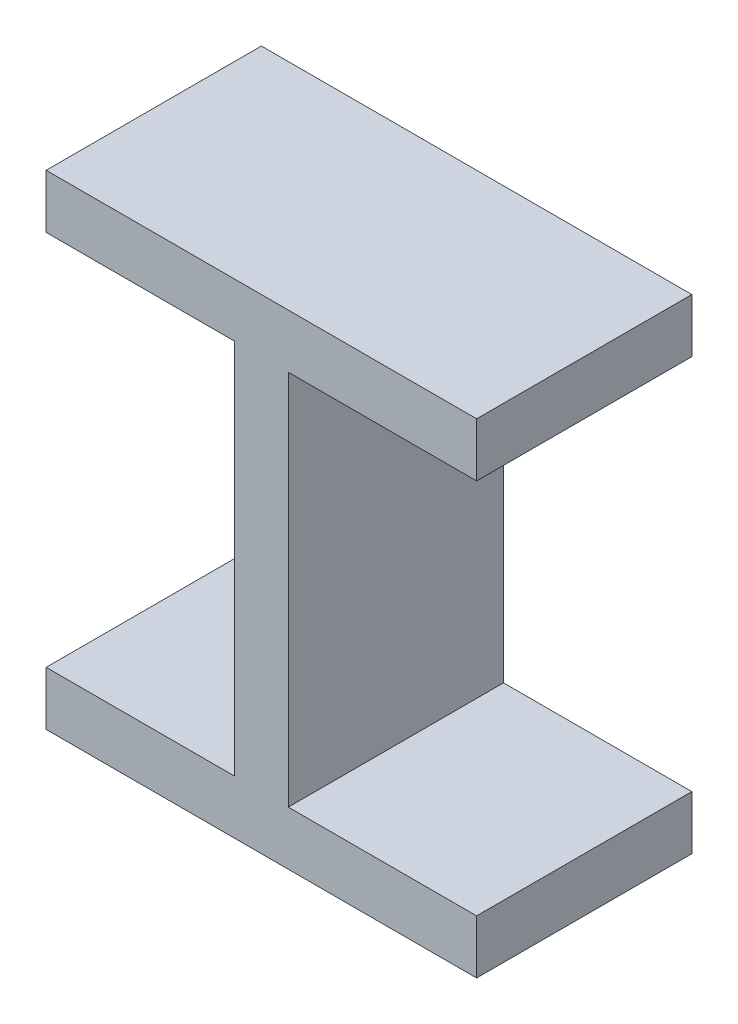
SolidWorks part; units mm, degrees
ref_plane "Front Plane" through (0, 0, 0) normal (0, 0, 1) x (1, 0, 0)
ref_plane "Top Plane" through (0, 0, 0) normal (0, 1, 0) x (1, 0, 0)
ref_plane "Right Plane" through (0, 0, 0) normal (1, 0, 0) x (0, 0, -1)
sketch "Sketch2" plane through (0, 0, 0) normal (0, 0, 1) x (1, 0, 0)
  line L0 (0, 110) -> (0, -90) construction
  line L1 (80, -90) -> (-80, -90)
  line L2 (-80, -90) -> (-80, -70)
  line L3 (80, -90) -> (80, -70)
  line L4 (-80, -70) -> (-10, -70)
  line L5 (80, -70) -> (10, -70)
  line L6 (-10, -70) -> (-10, 0)
  line L7 (10, -70) -> (10, 0)
  line L8 (-100.4082, 0) -> (99.5918, 0) construction
  line L9 (80, 90) -> (-80, 90)
  line L10 (10, 70) -> (10, 0)
  line L11 (80, 70) -> (10, 70)
  line L12 (80, 90) -> (80, 70)
  line L13 (-10, 70) -> (-10, 0)
  line L14 (-80, 70) -> (-10, 70)
  line L15 (-80, 90) -> (-80, 70)
  dimension "D1" = 160
  dimension "D2" = 20
  dimension "D3" = 140
  dimension "D4" = 20
  dimension "D5" = 70
extrude "Boss-Extrude1" add sketch "Sketch2" along normal blind 80 contours L9 L15 L14 L13 L6 L4 L2 L1 L3 L5 L7 L10 L11 L12
